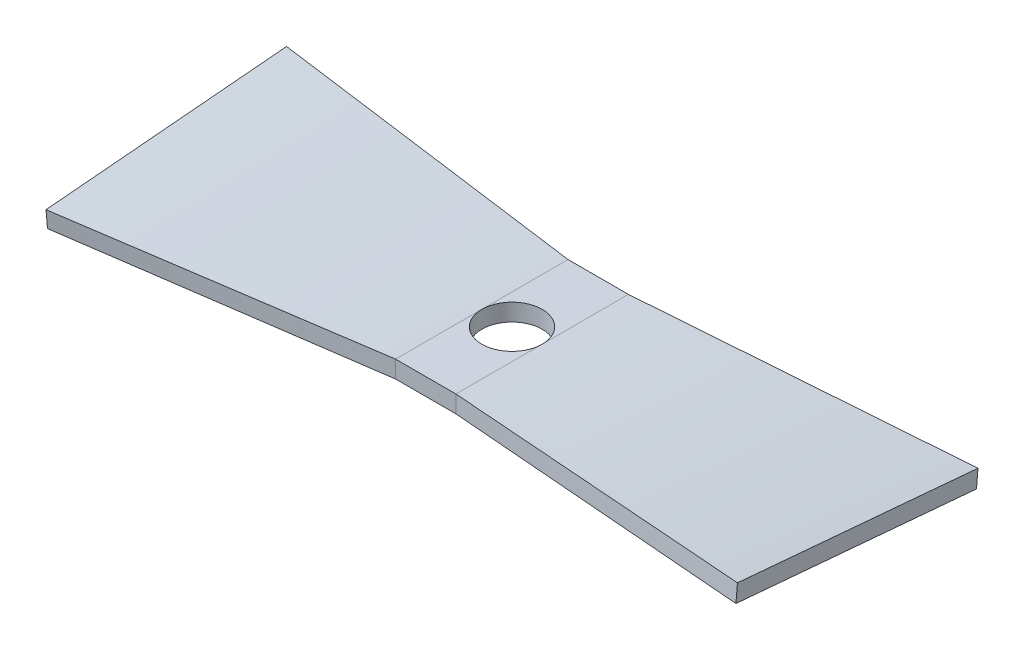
SolidWorks part; units mm, degrees
ref_plane "Front" through (0, 0, 0) normal (0, 0, 1) x (1, 0, 0)
ref_plane "Top" through (0, 0, 0) normal (0, 1, 0) x (1, 0, 0)
ref_plane "Right" through (0, 0, 0) normal (1, 0, 0) x (0, 0, -1)
sketch "Sketch1" plane through (0, 0, 0) normal (0, 1, 0) x (1, 0, 0)
  line L0 (1.75, 5) -> (1.75, -5)
  line L1 (-1.75, 5) -> (-1.75, -5)
  line L2 (20, 20) -> (20, -20)
  line L3 (-1.75, 5) -> (1.75, 5)
  line L4 (-20, 20) -> (-20, -20)
  line L7 (-1.75, -5) -> (1.75, -5)
ref_plane "Plane2" through (20, 0, 0) normal (-1, 0, 0) x (0, 0, 1)
sketch "Sketch6" plane through (20, 0, 0) normal (-1, 0, 0) x (0, 0, 1)
  line L1 (-6.9298, -1.1082) -> (7.0169, 0.112)
  line L2 (-7.0169, -0.112) -> (6.9298, 1.1082)
  line L3 (-7.0169, -0.112) -> (-6.9298, -1.1082)
  line L4 (6.9298, 1.1082) -> (7.0169, 0.112)
ref_plane "Plane3" through (-20, 0, 0) normal (-1, 0, 0) x (0, 0, 1)
sketch "Sketch7" plane through (-20, 0, 0) normal (-1, 0, 0) x (0, 0, 1)
  line L1 (7.0169, -0.112) -> (-6.9298, 1.1082)
  line L2 (6.9298, -1.1082) -> (-7.0169, 0.112)
  line L3 (-6.9298, 1.1082) -> (-7.0169, 0.112)
  line L4 (6.9298, -1.1082) -> (7.0169, -0.112)
extrude "Extrude3" add sketch "Sketch1" along normal mid plane 1
sketch "Sketch8" plane through (1.75, 0, 0) normal (1, 0, 0) x (0, 0, -1)
  line L1 (-5, 0.5) -> (5, 0.5)
  line L2 (-5, 0.5) -> (-5, -0.5)
  line L3 (-5, -0.5) -> (5, -0.5)
  line L4 (5, 0.5) -> (5, -0.5)
sketch "Sketch9" plane through (-1.75, 0, 0) normal (-1, 0, 0) x (0, 0, 1)
  line L1 (-5, 0.5) -> (5, 0.5)
  line L2 (-5, 0.5) -> (-5, -0.5)
  line L3 (-5, -0.5) -> (5, -0.5)
  line L4 (5, 0.5) -> (5, -0.5)
loft "Loft4" add profiles "Sketch6", "Sketch8"
loft "Loft5" add profiles "Sketch7", "Sketch9"
sketch "Sketch10" plane through (0, 0.5, 0) normal (0, 1, 0) x (-1, 0, 0)
  circle A0 centre (0, 0) radius 1.75
extrude "Cut-Extrude1" cut sketch "Sketch10" against normal blind 1
